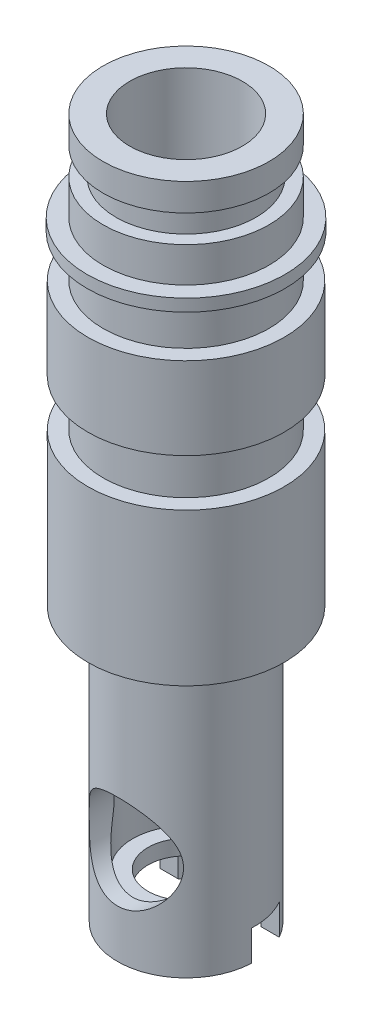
SolidWorks part; units mm, degrees
ref_plane "Plane1" through (0, 0, 0) normal (0, 0, 1) x (1, 0, 0)
ref_plane "Plane2" through (0, 0, 0) normal (0, 1, 0) x (1, 0, 0)
ref_plane "Plane3" through (0, 0, 0) normal (1, 0, 0) x (0, 0, -1)
sketch "Sketch2" plane through (0, 0, 0) normal (0, 0, 1) x (1, 0, 0)
  line L0 (0, 0) -> (0, -66.7498) construction
  line L1 (0, 0) -> (6.9215, 0)
  line L2 (6.9215, 0) -> (6.9215, -12.065)
  line L3 (6.9215, -12.065) -> (8.1915, -12.065)
  line L4 (8.1915, -12.065) -> (8.1915, -18.923)
  line L5 (8.1915, -18.923) -> (6.9215, -18.923)
  line L6 (6.9215, -18.923) -> (6.9215, -22.86)
  line L7 (6.9215, -22.86) -> (8.1915, -22.86)
  line L8 (8.1915, -22.86) -> (8.1915, -35.56)
  line L9 (8.1915, -35.56) -> (5.715, -35.56)
  line L10 (5.715, -35.56) -> (5.715, -58.42)
  line L11 (5.715, -58.42) -> (0, -58.42)
  line L12 (0, -58.42) -> (0, 0)
  dimension "D1" = 6.9215
  dimension "D2" = 8.1915
  dimension "D3" = 5.715
  dimension "D4" = 12.065
  dimension "D5" = 6.858
  dimension "D6" = 12.7
  dimension "D7" = 22.86
  dimension "D8" = 58.42
revolve "Main Shaft" add sketch "Sketch2" angle 360 about L0
sketch "Sketch3" plane through (0, 0, 0) normal (0, 0, 1) x (1, 0, 0)
  line L0 (0, 0) -> (0, -21.1506) construction
  line L1 (6.9215, -2.286) -> (5.842, -2.286)
  line L2 (6.9215, -2.286) -> (6.9215, -4.572)
  line L3 (5.842, -4.572) -> (6.9215, -4.572)
  line L4 (5.842, -4.572) -> (5.842, -2.286)
  point P7 (6.9215, 0)
  dimension "D1" = 2.286
  dimension "D2" = 2.286
  dimension "D3" = 5.842
revolve "Top Groove" cut sketch "Sketch3" angle 360 about L0
sketch "Sketch4" plane through (0, 0, 0) normal (0, 0, 1) x (1, 0, 0)
  line L0 (0, 0) -> (0, -11.861) construction
  line L1 (6.9215, -7.493) -> (8.255, -7.493)
  line L2 (6.9215, -7.493) -> (6.9215, -8.509)
  line L3 (8.255, -8.509) -> (6.9215, -8.509)
  line L4 (8.255, -8.509) -> (8.255, -7.493)
  line L5 (8.1915, -12.065) -> (-8.1915, -12.065) construction
  point P7 (6.9215, 0)
  dimension "D1" = 1.016
  dimension "D2" = 8.255
  dimension "D3" = 3.556
revolve "Upper Flange" add sketch "Sketch4" angle 360 about L0
sketch "Sketch5" plane through (0, 0, 0) normal (0, 0, 1) x (1, 0, 0)
  line L0 (0, 0) -> (0, -60.363) construction
  line L1 (0, 0) -> (4.699, 0)
  line L2 (4.699, 0) -> (4.699, -23.3593)
  line L3 (4.699, -23.3593) -> (4.445, -23.3593)
  line L4 (4.445, -23.3593) -> (4.445, -58.42)
  line L5 (4.445, -58.42) -> (0, -58.42)
  line L6 (0, -58.42) -> (0, 0)
  line L7 (5.715, -58.42) -> (-5.715, -58.42) construction
  line L8 (8.1915, -22.86) -> (-8.1915, -22.86) construction
  dimension "D1" = 4.445
  dimension "D2" = 4.699
  dimension "D3" = 0.4993
revolve "ID" cut sketch "Sketch5" angle 360 about L0
sketch "Sketch6" plane through (0, 0, 0) normal (0, 0, 1) x (1, 0, 0)
  line L0 (0, -50) -> (0, 50) construction
  line L1 (50, 0) -> (-50, 0) construction
  circle A0 centre (0, -50.4698) radius 3.937
  dimension "D1" = 7.874
  dimension "D2" = 50.4698
extrude "Air Out 2 Mouthpiece" cut sketch "Sketch6" along normal through all
sketch "Sketch7" plane through (0, 0, 0) normal (0, 0, 1) x (1, 0, 0)
  line L0 (50, 0) -> (-50, 0) construction
  line L1 (0, -50) -> (0, 50) construction
  circle A0 centre (0, -15.3416) radius 2.3495
  dimension "D1" = 4.699
  dimension "D2" = 15.3416
extrude "Air Out 2 BC" cut sketch "Sketch7" against normal through all
sketch "Sketch8" plane through (0, 0, 0) normal (0, 0, 1) x (1, 0, 0)
  line L0 (0, -50) -> (0, 50) construction
  line L1 (5.715, -58.42) -> (-5.715, -58.42) construction
  circle A0 centre (0, -49.53) radius 1.27
  dimension "D2" = 2.54
  dimension "D1" = 8.89
extrude "Vent" cut sketch "Sketch8" against normal through all
sketch "Sketch9" plane through (0, 0, 0) normal (1, 0, 0) x (0, 0, -1)
  line L0 (2.794, -58.42) -> (-0.254, -58.42)
  line L1 (2.794, -58.42) -> (2.794, -55.88)
  line L2 (-0.254, -55.88) -> (2.794, -55.88)
  line L3 (-0.254, -55.88) -> (-0.254, -58.42)
  line L4 (0, 50) -> (0, -50) construction
  line L5 (-5.715, -58.42) -> (5.715, -58.42) construction
  point P4 (1.27, -55.88)
  dimension "D1" = 1.27
  dimension "D2" = 3.048
  dimension "D3" = 2.54
extrude "Slot for Demand Lever" cut sketch "Sketch9" against normal through all and the other way through all
chamfer "Chamfer1" distance 0.254 angle 45
chamfer "Chamfer2" distance 0.127 angle 45
sketch "Sketch10" plane through (0, -35.56, 0) normal (0, -1, 0) x (1, 0, 0)
  line L0 (-8.1915, -5.715) -> (8.1915, -5.715)
  line L1 (-8.1915, -5.715) -> (-8.1915, -8.1915)
  line L2 (8.1915, -8.1915) -> (-8.1915, -8.1915)
  line L3 (8.1915, -8.1915) -> (8.1915, -5.715)
  circle A0 centre (0, 0) radius 5.715 construction
  circle A2 centre (0, 0) radius 8.1915 construction
extrude "Clocking cut" cut sketch "Sketch10" against normal blind 2.54
fillet "Fillet1" radius 0.254
chamfer "Chamfer3" distance 0.254 angle 45
sketch "Sketch11" plane through (0, -55.88, 0) normal (0, -1, 0) x (1, 0, 0)
  circle A0 centre (0, 0) radius 4.445
  circle A1 centre (0, 0) radius 4.445 construction
  circle A2 centre (0, 0) radius 3.175
  dimension "D1" = 6.35
extrude "Spring Rest" add sketch "Sketch11" against normal blind 1.27
sketch "Sketch12" plane through (0, 0, 0) normal (1, 0, 0) x (0, 0, -1)
  line L0 (-24.6337, 8.7951) -> (21.4175, 8.7951)
  line L1 (-24.6337, 8.7951) -> (-24.6337, -65.6744)
  line L2 (21.4175, -65.6744) -> (-24.6337, -65.6744)
  line L3 (21.4175, -65.6744) -> (21.4175, 8.7951)
extrude "CutAway" cut sketch "Sketch12" against normal through all
